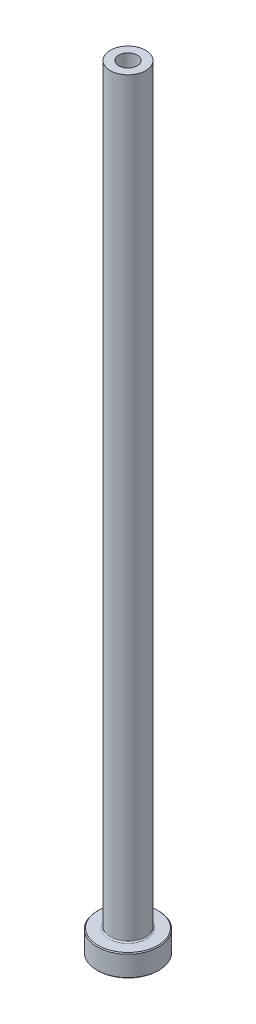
SolidWorks part; units mm, degrees
ref_plane "Front Plane" through (0, 0, 0) normal (0, 0, 1) x (1, 0, 0)
ref_plane "Top Plane" through (0, 0, 0) normal (0, 1, 0) x (1, 0, 0)
ref_plane "Right Plane" through (0, 0, 0) normal (1, 0, 0) x (0, 0, -1)
sketch "Sketch1" plane through (0, 0, 0) normal (0, 0, 1) x (1, 0, 0)
  line L0 (-2.1, 175) -> (-4, 175)
  line L1 (-4, 175) -> (-4, 5)
  line L2 (-4, 5) -> (-7, 5)
  line L3 (-7, 5) -> (-7, 0)
  line L4 (7.7, 0) -> (-7.7, 0) construction
  line L5 (-7, 0) -> (-2.35, 0)
  line L6 (-2.1, 130) -> (-2.1, 175)
  line L7 (0, 92.1877) -> (0, -15.5353) construction
  line L8 (0, -7.7) -> (0, 7.7) construction
  line L9 (-2.1, 130) -> (-2.35, 118)
  line L10 (-2.35, 118) -> (-2.35, 0)
  dimension "D1" = 0.25
  dimension "ID" = 4.2
  dimension "OD" = 8
  dimension "L" = 175
  dimension "H" = 14
  dimension "T" = 5
  dimension "N" = 45
  dimension "D2" = 12
revolve "Revolve1" add sketch "Sketch1" angle 360 about L7
fillet "Fillet1" radius 0.3 1 edges at (0, 5, 4)
chamfer "Chamfer1" distance 0.2 angle 45 2 edges at (0, 5, 7) (0, 0, 7)
chamfer "Chamfer3" distance 0.5 angle 45 1 edges at (0, 0, 2.35)
